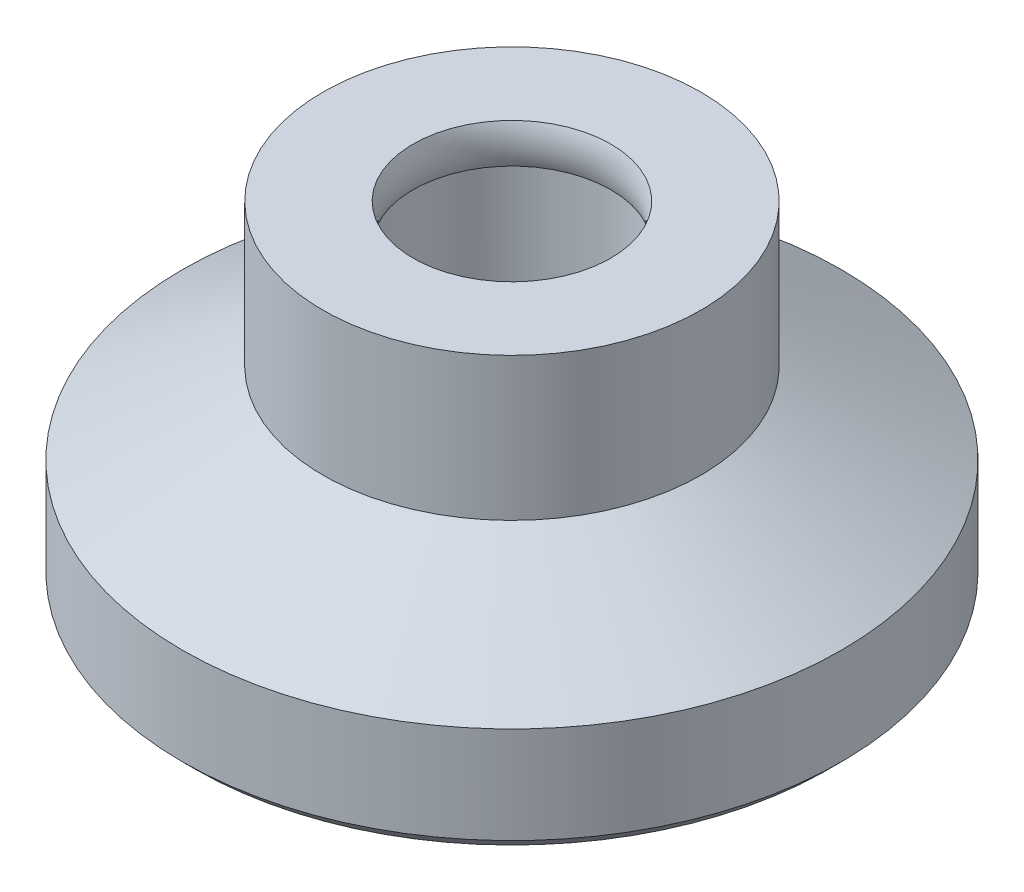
SolidWorks part; units mm, degrees
ref_plane "Front Plane" through (0, 0, 0) normal (0, 0, 1) x (1, 0, 0)
ref_plane "Top Plane" through (0, 0, 0) normal (0, 1, 0) x (1, 0, 0)
ref_plane "Right Plane" through (0, 0, 0) normal (1, 0, 0) x (0, 0, -1)
sketch "Sketch1" plane through (0, 0, 0) normal (0, 1, 0) x (1, 0, 0)
  circle A0 centre (0, 0) radius 4.3
  dimension "D1" = 8.6
extrude "Extrude1" add sketch "Sketch1" along normal mid plane 7.6
sketch "Sketch3" plane through (0, -3.8, 0) normal (0, -1, 0) x (1, 0, 0)
  circle A0 centre (0, 0) radius 7.5
  dimension "D1" = 15
extrude "Extrude2" add sketch "Sketch3" against normal blind 2.5
sketch "Sketch4" plane through (0, 0, 0) normal (0, 0, 1) x (1, 0, 0)
  line L0 (-7.5, -1.3) -> (-4.3, 0.5475)
  line L1 (-4.3, 3.8) -> (-4.3, -1.3) construction
  line L2 (-4.3, 0.5475) -> (-4.3, -1.3)
  line L3 (-4.3, -1.3) -> (-7.5, -1.3)
  dimension "D1" = 30
revolve "Revolve1" add sketch "Sketch4" angle 360 about axis through (0, 3.8, 0) along (0, -1, 0)
chamfer "Chamfer1" distance 0.3 angle 45 1 edges at (0, -3.8, -7.5)
sketch "Sketch5" plane through (0, 0, 0) normal (0, 0, 1) x (1, 0, 0)
  line L1 (0, 0) -> (0, 11.3083) construction
  line L2 (0, 3.8) -> (2.25, 3.8)
  line L3 (4.3, 3.8) -> (-4.3, 3.8) construction
  line L4 (2.25, 2.9) -> (2.25, -0.001)
  line L5 (2.25, -0.001) -> (0, -1.3)
  line L6 (0, -1.3) -> (0, 3.8)
  line L7 (7.5, -1.3) -> (-7.5, -1.3) construction
  arc A0 (2.25, 3.8) -> (2.25, 2.9) centre (3.33, 3.35) ccw
  point P14 (2.16, 3.35)
  dimension "D2" = 4.5
  dimension "D1" = 60
  dimension "D3" = 0.9
  dimension "D4" = 0.09
revolve "Cut-Revolve1" cut sketch "Sketch5" angle 360 about L1
equation "\"D3@Sketch5\" = \"D2@Sketch5\"*0.2"
equation "\"D4@Sketch5\" = \"D3@Sketch5\"*0.1"
